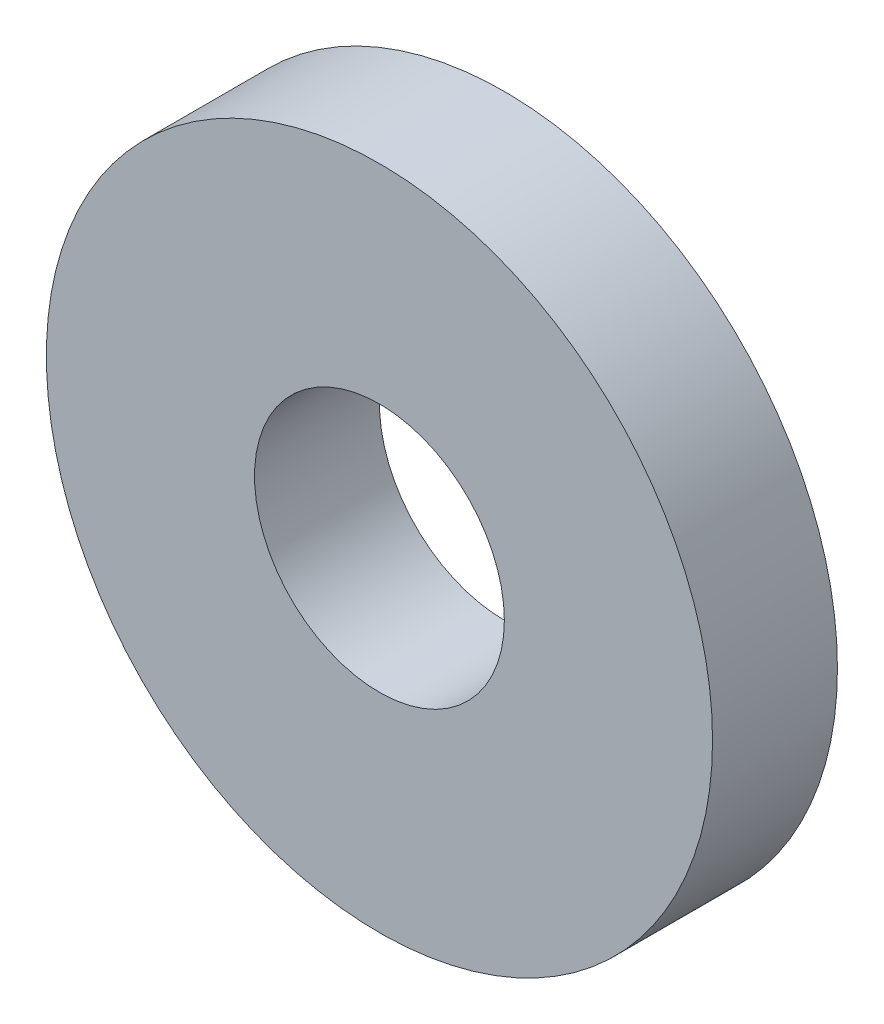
SolidWorks part; units mm, degrees
ref_plane "Front Plane" through (0, 0, 0) normal (0, 0, 1) x (1, 0, 0)
ref_plane "Top Plane" through (0, 0, 0) normal (0, 1, 0) x (1, 0, 0)
ref_plane "Right Plane" through (0, 0, 0) normal (1, 0, 0) x (0, 0, -1)
sketch "Sketch1" plane through (0, 0, 0) normal (0, 0, 1) x (1, 0, 0)
  circle A0 centre (-396.3638, -302.222) radius 30 construction
  circle A1 centre (-396.3638, -302.222) radius 30
  circle A2 centre (-396.3638, -302.222) radius 80
extrude "Extrude1" add sketch "Sketch1" against normal blind 30
